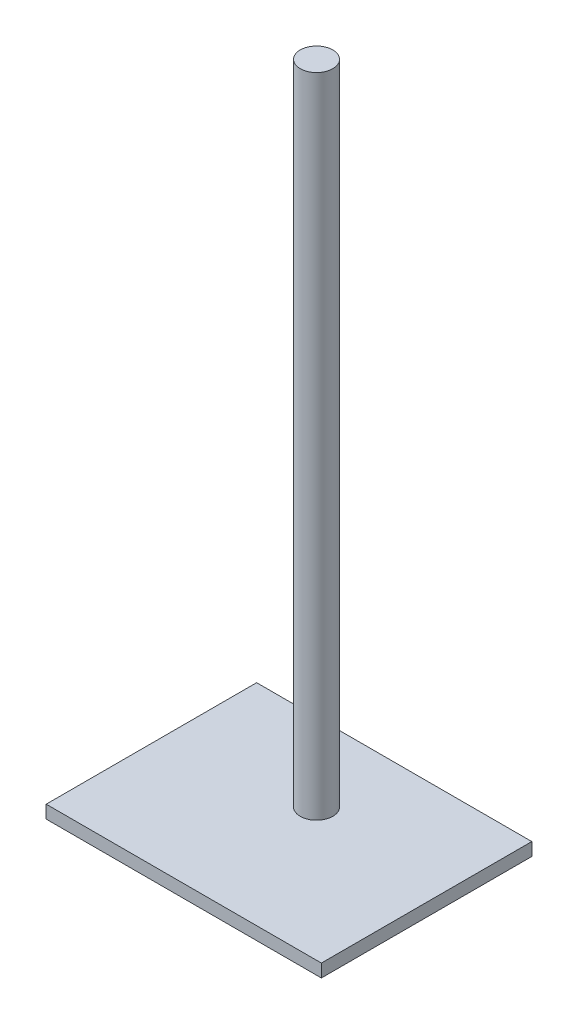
SolidWorks part; units mm, degrees
ref_plane "Ebene vorne" through (0, 0, 0) normal (0, 0, 1) x (1, 0, 0)
ref_plane "Ebene oben" through (0, 0, 0) normal (0, 1, 0) x (1, 0, 0)
ref_plane "Ebene rechts" through (0, 0, 0) normal (1, 0, 0) x (0, 0, -1)
sketch "Skizze1" plane through (0, 0, 0) normal (0, 1, 0) x (1, 0, 0)
  line L1 (-40.5, -20.5) -> (40.5, -20.5) construction
  line L2 (-40.5, -20.5) -> (-40.5, 20.5) construction
  line L3 (-40.5, 20.5) -> (40.5, 20.5) construction
  line L4 (40.5, -20.5) -> (40.5, 20.5) construction
  line L5 (-40.5, -20.5) -> (40.5, 20.5) construction
  line L6 (-40.5, 20.5) -> (40.5, -20.5) construction
  circle A0 centre (0, 0) radius 25.15
  point P0 (0, 0)
  dimension "D3" = 50.3
  dimension "D1" = 81
  dimension "D2" = 41
extrude "Aufsatz-Linear austragen1" add sketch "Skizze1" along normal mid plane 1000
sketch "Skizze2" plane through (0, -500, 0) normal (0, -1, 0) x (1, 0, 0)
  line L1 (-212.5, -120) -> (212.5, -120)
  line L2 (-212.5, -120) -> (-212.5, 205)
  line L3 (-212.5, 205) -> (212.5, 205)
  line L4 (212.5, -120) -> (212.5, 205)
  line L5 (-212.5, -120) -> (212.5, 205) construction
  line L6 (-212.5, 205) -> (212.5, -120) construction
  point P8 (0, -120)
  dimension "D1" = 425
  dimension "D2" = 325
  dimension "D3" = 120
extrude "Aufsatz-Linear austragen2" add sketch "Skizze2" along normal blind 20
